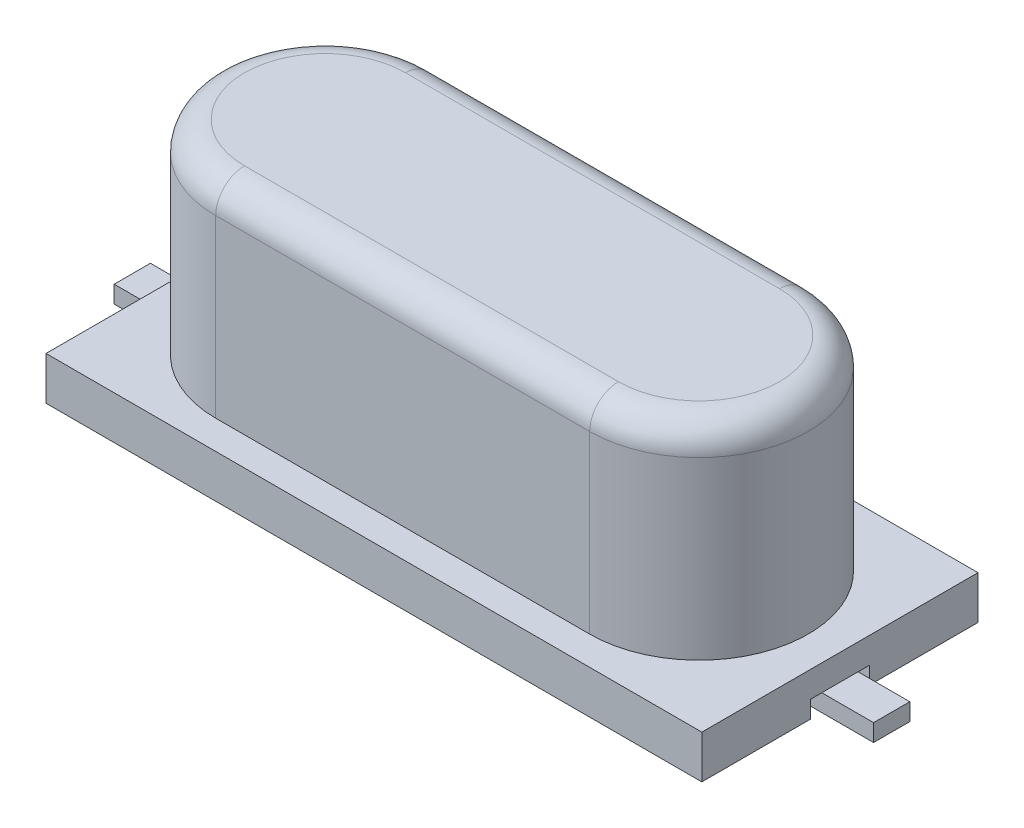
SolidWorks part; units mm, degrees
ref_plane "Front" through (0, 0, 0) normal (0, 0, 1) x (1, 0, 0)
ref_plane "Top" through (0, 0, 0) normal (0, 1, 0) x (1, 0, 0)
ref_plane "Right" through (0, 0, 0) normal (1, 0, 0) x (0, 0, -1)
sketch "Эскиз1" plane through (0, 0, 0) normal (0, 1, 0) x (1, 0, 0)
  line L0 (0, 0.315) -> (0, -0.315) construction
  line L1 (-6.6, -0.315) -> (-2.2, -0.315)
  line L2 (-6.6, -0.315) -> (-6.6, 0.315)
  line L3 (-6.6, 0.315) -> (-2.2, 0.315)
  line L4 (-2.2, -0.315) -> (-2.2, 0.315)
  line L5 (2.2, -0.315) -> (2.2, 0.315)
  line L6 (6.6, 0.315) -> (2.2, 0.315)
  line L7 (6.6, -0.315) -> (6.6, 0.315)
  line L8 (6.6, -0.315) -> (2.2, -0.315)
  line L10 (-4.4, -0.315) -> (-4.4, 0.315) construction
  line L11 (4.4, -0.315) -> (4.4, 0.315) construction
  dimension "D1" = 0.63
  dimension "D2" = 8.8
  dimension "D3" = 4.4
  dimension "D4" = 4.4
  dimension "D5" = 13.2
extrude "Вытянуть1" add sketch "Эскиз1" along normal blind 0.3
sketch "Эскиз2" plane through (0, 0, 0) normal (0, 1, 0) x (1, 0, 0)
  line L0 (2, 0.515) -> (2, -0.515)
  line L1 (2, -0.515) -> (5.7, -0.515)
  line L2 (2, -0.515) -> (6.8, -0.515) construction
  line L3 (5.7, 0.515) -> (2, 0.515)
  line L4 (2.2, 0.315) -> (2.2, -0.315)
  line L5 (6.6, 0.315) -> (2.2, 0.315)
  line L6 (6.6, -0.315) -> (6.6, 0.315)
  line L7 (2.2, -0.315) -> (6.6, -0.315)
  line L8 (2.2, 0.315) -> (2.2, -0.315) construction
  line L9 (6.6, 0.315) -> (2.2, 0.315) construction
  line L10 (6.6, -0.315) -> (6.6, 0.315) construction
  line L11 (2.2, -0.315) -> (6.6, -0.315) construction
  line L12 (-6.6, -0.315) -> (-2.2, -0.315)
  line L13 (-2.2, -0.315) -> (-2.2, 0.315)
  line L14 (-2.2, 0.315) -> (-6.6, 0.315)
  line L15 (-6.6, 0.315) -> (-6.6, -0.315)
  line L16 (-6.6, -0.315) -> (-2.2, -0.315) construction
  line L17 (-2.2, -0.315) -> (-2.2, 0.315) construction
  line L18 (-2.2, 0.315) -> (-6.6, 0.315) construction
  line L19 (-6.6, 0.315) -> (-6.6, -0.315) construction
  line L20 (-5.7, -0.515) -> (-2, -0.515)
  line L21 (-2, -0.515) -> (-2, 0.515)
  line L22 (-2, 0.515) -> (-5.7, 0.515)
  line L23 (-6.8, -0.515) -> (-2, -0.515) construction
  line L24 (0, 0.315) -> (0, -0.315) construction
  line L25 (-5.7, 0) -> (5.7, 0) construction
  line L26 (-5.7, 2.4) -> (5.7, 2.4) construction
  line L27 (-5.7, -2.4) -> (5.7, -2.4)
  line L28 (-5.7, 2.4) -> (5.7, 2.4)
  line L29 (0, 2.4) -> (0, -2.4) construction
  line L30 (-2, 0.515) -> (-6.8, 0.515) construction
  line L31 (-6.8, 0.515) -> (-6.8, -0.515) construction
  line L32 (6.8, 0.515) -> (2, 0.515) construction
  line L33 (6.8, -0.515) -> (6.8, 0.515) construction
  line L34 (-5.7, -2.4) -> (5.7, -2.4) construction
  line L35 (-5.7, -0.515) -> (-5.7, -2.4)
  line L36 (-5.7, 0.515) -> (-5.7, 2.4)
  line L37 (5.7, 0.515) -> (5.7, 2.4)
  line L38 (5.7, -2.4) -> (5.7, -0.515)
  point P18 (0, 0)
  dimension "D6" = 11.4
  dimension "D7" = 4.8
  dimension "D1" = 0
  dimension "D2" = 0
  dimension "D3" = 0.2
  dimension "D4" = 2.4
  dimension "D5" = 2.4
extrude "Вытянуть2" add sketch "Эскиз2" along normal blind 0.3
sketch "Эскиз3" plane through (0, 0.3, 0) normal (0, 1, 0) x (-1, 0, 0)
  line L1 (5.7, 2.4) -> (-5.7, 2.4)
  line L2 (5.7, 2.4) -> (5.7, -2.4)
  line L3 (5.7, -2.4) -> (-5.7, -2.4)
  line L4 (-5.7, 2.4) -> (-5.7, -2.4)
extrude "Вытянуть3" add sketch "Эскиз3" along normal blind 0.45
sketch "Эскиз4" plane through (0, 0.75, 0) normal (0, 1, 0) x (-1, 0, 0)
  line L0 (3.25, 0) -> (-3.25, 0) construction
  line L1 (3.25, -1.9) -> (-3.25, -1.9)
  line L2 (3.25, 1.9) -> (-3.25, 1.9)
  arc A0 (3.25, -1.9) -> (3.25, 1.9) centre (3.25, 0) ccw
  arc A1 (-3.25, 1.9) -> (-3.25, -1.9) centre (-3.25, 0) ccw
  point P2 (0, 0)
  dimension "D1" = 10.3
  dimension "D2" = 3.8
extrude "Вытянуть4" add sketch "Эскиз4" along normal blind 3.55
fillet "Скругление1" radius 0.5 4 edges at (0, 4.3, -1.9) (5.15, 4.3, 0) (0, 4.3, 1.9) (-5.15, 4.3, 0)
